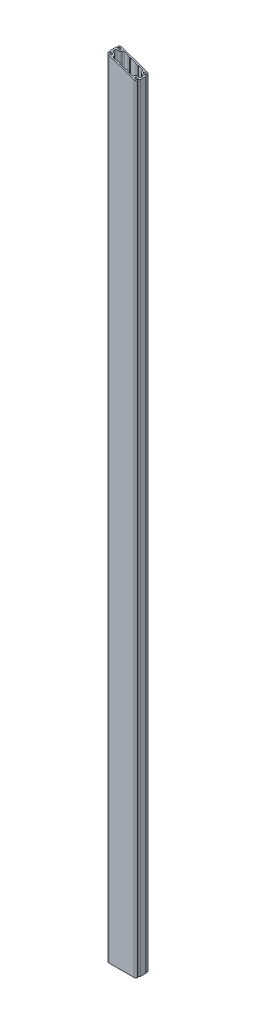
SolidWorks part; units mm, degrees
ref_plane "Alzado" through (0, 0, 0) normal (0, 0, 1) x (1, 0, 0)
ref_plane "Planta" through (0, 0, 0) normal (0, 1, 0) x (1, 0, 0)
ref_plane "Vista lateral" through (0, 0, 0) normal (1, 0, 0) x (0, 0, -1)
sketch "Croquis2" plane through (0, 0, 0) normal (0, 1, 0) x (1, 0, 0)
  line L0 (-183.2758, 0) -> (156.0252, 0) construction
  line L1 (0, 113.0945) -> (0, -113.0945) construction
  line L2 (90, -15.8204) -> (90, 15.8204)
  line L3 (75.5, 40) -> (-75.5, 40)
  line L4 (-17.4827, 32) -> (17.4827, 32)
  line L5 (20, 29) -> (30, 29)
  line L6 (123.5786, 25.5) -> (27.4214, 25.5) construction
  line L7 (75.5, 71.4027) -> (75.5, -20.4027) construction
  line L8 (82, 4.5) -> (82, -4.5)
  line L9 (20, 29) -> (17.4827, 32)
  line L10 (30, 29) -> (32.5173, 32)
  line L11 (32.5173, 32) -> (54.5, 32)
  line L12 (75.5, -71.4027) -> (75.5, 20.4027) construction
  line L13 (123.5786, -25.5) -> (27.4214, -25.5) construction
  line L14 (32.5173, -32) -> (54.5, -32)
  line L15 (30, -29) -> (32.5173, -32)
  line L16 (20, -29) -> (17.4827, -32)
  line L17 (20, -29) -> (30, -29)
  line L18 (-17.4827, -32) -> (17.4827, -32)
  line L19 (75.5, -40) -> (-75.5, -40)
  line L20 (-123.5786, -25.5) -> (-27.4214, -25.5) construction
  line L21 (-75.5, -71.4027) -> (-75.5, 20.4027) construction
  line L22 (-75.5, 71.4027) -> (-75.5, -20.4027) construction
  line L23 (-123.5786, 25.5) -> (-27.4214, 25.5) construction
  line L24 (-20, -29) -> (-30, -29)
  line L25 (-20, -29) -> (-17.4827, -32)
  line L26 (-30, -29) -> (-32.5173, -32)
  line L27 (-32.5173, -32) -> (-54.5, -32)
  line L28 (-32.5173, 32) -> (-54.5, 32)
  line L29 (-30, 29) -> (-32.5173, 32)
  line L30 (-20, 29) -> (-17.4827, 32)
  line L31 (-82, 4.5) -> (-82, -4.5)
  line L32 (-20, 29) -> (-30, 29)
  line L33 (-90, -15.8204) -> (-90, 15.8204)
  arc A0 (88.1963, 32.5039) -> (75.5, 40) centre (75.5, 25.5) ccw
  arc A1 (81.1914, 28.6397) -> (79.722, 20.5579) centre (75.5, 25.5) ccw
  arc A3 (61, 25.5) -> (54.5, 32) centre (54.5, 25.5) ccw
  arc A4 (81.1914, 28.6397) -> (88.1963, 32.5039) centre (84.6939, 30.5718) ccw
  arc A5 (90, 15.8204) -> (79.722, 20.5579) centre (83.7692, 15.8204) ccw
  arc A6 (82, 4.5) -> (75.5, 11) centre (75.5, 4.5) ccw
  arc A7 (61, 25.5) -> (75.5, 11) centre (75.5, 25.5) ccw
  arc A8 (61, -25.5) -> (75.5, -11) centre (75.5, -25.5) cw
  arc A9 (82, -4.5) -> (75.5, -11) centre (75.5, -4.5) cw
  arc A10 (90, -15.8204) -> (79.722, -20.5579) centre (83.7692, -15.8204) cw
  arc A11 (81.1914, -28.6397) -> (88.1963, -32.5039) centre (84.6939, -30.5718) cw
  arc A12 (61, -25.5) -> (54.5, -32) centre (54.5, -25.5) cw
  arc A13 (81.1914, -28.6397) -> (79.722, -20.5579) centre (75.5, -25.5) cw
  arc A14 (88.1963, -32.5039) -> (75.5, -40) centre (75.5, -25.5) cw
  arc A15 (-88.1963, -32.5039) -> (-75.5, -40) centre (-75.5, -25.5) ccw
  arc A16 (-81.1914, -28.6397) -> (-79.722, -20.5579) centre (-75.5, -25.5) ccw
  arc A17 (-61, -25.5) -> (-54.5, -32) centre (-54.5, -25.5) ccw
  arc A18 (-81.1914, -28.6397) -> (-88.1963, -32.5039) centre (-84.6939, -30.5718) ccw
  arc A19 (-90, -15.8204) -> (-79.722, -20.5579) centre (-83.7692, -15.8204) ccw
  arc A20 (-82, -4.5) -> (-75.5, -11) centre (-75.5, -4.5) ccw
  arc A21 (-61, -25.5) -> (-75.5, -11) centre (-75.5, -25.5) ccw
  arc A22 (-61, 25.5) -> (-75.5, 11) centre (-75.5, 25.5) cw
  arc A23 (-82, 4.5) -> (-75.5, 11) centre (-75.5, 4.5) cw
  arc A24 (-90, 15.8204) -> (-79.722, 20.5579) centre (-83.7692, 15.8204) cw
  arc A25 (-81.1914, 28.6397) -> (-88.1963, 32.5039) centre (-84.6939, 30.5718) cw
  arc A26 (-61, 25.5) -> (-54.5, 32) centre (-54.5, 25.5) cw
  arc A27 (-81.1914, 28.6397) -> (-79.722, 20.5579) centre (-75.5, 25.5) cw
  arc A28 (-88.1963, 32.5039) -> (-75.5, 40) centre (-75.5, 25.5) cw
  point P6 (0, 0)
  point P8 (-90, 0)
  point P9 (0, 40)
  point P17 (75.5, 25.5)
  point P20 (75.5, 25.5)
  point P56 (82, 0)
  point P58 (90, 0)
  point P94 (0, -40)
  point P95 (0, -32)
  point P102 (0, 32)
  point P103 (-82, 0)
  dimension "D5" = 14.5
  dimension "D6" = 6.5
  dimension "D7" = 6.2308
  dimension "D8" = 9.1939
  dimension "D1" = 90
  dimension "D2" = 40
  dimension "D3" = 8
  dimension "D4" = 8
  dimension "D9" = 21
  dimension "D10" = 10
  dimension "D11" = 20
  dimension "D12" = 3
  dimension "D13" = 50
  dimension "D14" = 50
extrude "Saliente-Extruir1" add sketch "Croquis2" along normal blind 4733
sketch "Croquis3" plane through (0, 0, 40) normal (0, 0, 1) x (1, 0, 0)
  line L0 (90, 4670.6) -> (375.8161, 4670.6) construction
  line L1 (90, 4733) -> (90, 0) construction
  line L2 (90, 4670.6) -> (-298.4993, 4805.2798) construction
  line L3 (-90, 4733) -> (90, 4733) construction
  line L4 (-90, 4733) -> (90, 4733)
  line L5 (90, 4733) -> (90, 4670.6)
  line L6 (90, 4670.6) -> (-90, 4733)
  dimension "D1" = 160.88
extrude "Cortar-Extruir1" cut sketch "Croquis3" against normal through all
